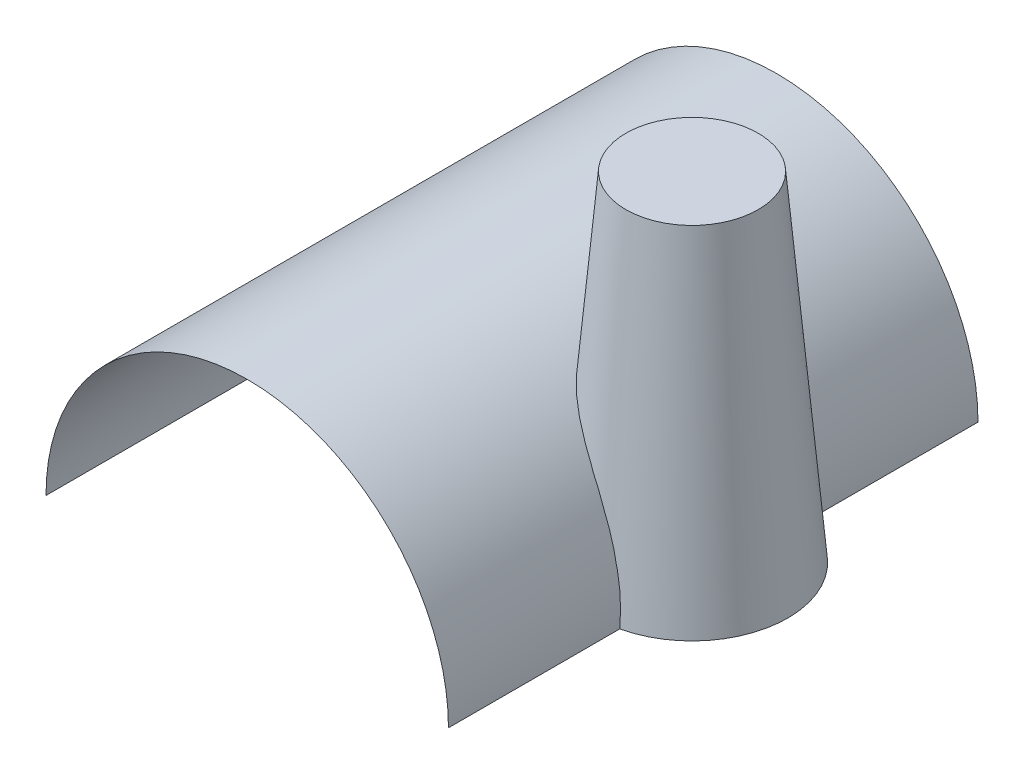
SolidWorks part; units mm, degrees
ref_plane "Front Plane" through (0, 0, 0) normal (0, 0, 1) x (1, 0, 0)
ref_plane "Top Plane" through (0, 0, 0) normal (0, 1, 0) x (1, 0, 0)
ref_plane "Right Plane" through (0, 0, 0) normal (1, 0, 0) x (0, 0, -1)
sketch "Sketch1" plane through (0, 0, 0) normal (0, 0, 1) x (1, 0, 0)
  line L0 (-19, 0) -> (19, 0) construction
  arc A0 (19, 0) -> (-19, 0) centre (0, 0) ccw
  dimension "D1" = 38
ref_plane "Plane1" through (0, 32, 0) normal (0, 1, 0) x (-1, 0, 0)
sketch "Sketch2" plane through (0, 32, 0) normal (0, 1, 0) x (-1, 0, 0)
  line L2 (19, 0) -> (-19, 0) construction
  line L3 (0, 17.6) -> (0, -17.6) construction
  circle A0 centre (-17, -25) radius 6.25
  dimension "D3" = 12.5
  dimension "D2" = 17
  dimension "D1" = 25
surface "Surface-Extrude1" sketch "Sketch1" parameters "D1"=50
surface "Surface-Extrude2" sketch "Sketch2" parameters "D3"=5
surface "Surface-Plane1"
